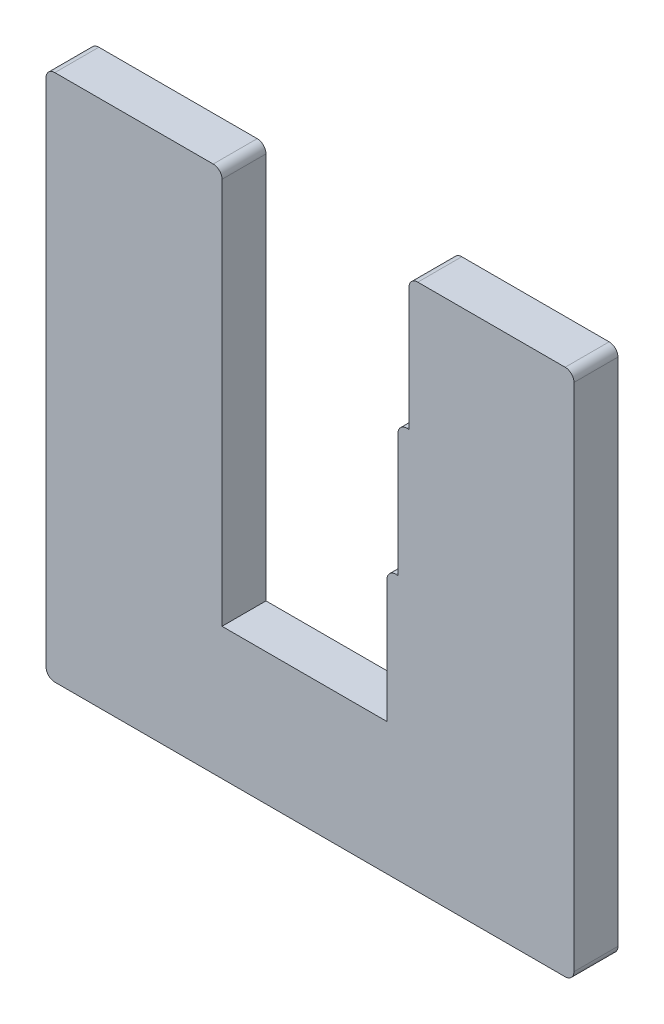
SolidWorks part; units mm, degrees
other "Objet de détail1"
other "Objet de détail2"
other "Objet de détail3"
ref_plane "Plan de face" through (0, 0, 0) normal (0, 0, 1) x (1, 0, 0)
ref_plane "Plan de dessus" through (0, 0, 0) normal (0, 1, 0) x (1, 0, 0)
ref_plane "Plan de droite" through (0, 0, 0) normal (1, 0, 0) x (0, 0, -1)
sketch "Esquisse1" plane through (0, 0, 0) normal (0, 0, 1) x (1, 0, 0)
  line L1 (0, 0) -> (120, 0)
  line L2 (0, 0) -> (0, 120)
  line L3 (0, 120) -> (120, 120)
  line L4 (120, 0) -> (120, 120)
  dimension "D1" = 120
  dimension "D2" = 120
extrude "Boss.-Extru.1" add sketch "Esquisse1" along normal blind 10
sketch "Esquisse2" plane through (0, 0, 10) normal (0, 0, 1) x (1, 0, 0)
  line L0 (120, 120) -> (0, 120) construction
  line L1 (40, 120) -> (82.5, 120)
  line L2 (40, 120) -> (40, 90)
  line L3 (40, 90) -> (82.5, 90)
  line L4 (82.5, 120) -> (82.5, 90)
  line L5 (0, 120) -> (0, 0) construction
  dimension "D1" = 40
  dimension "D2" = 42.5
  dimension "D3" = 30
extrude "Enlèv. mat.-Extru.1" cut sketch "Esquisse2" against normal blind 10
sketch "Esquisse3" plane through (0, 0, 10) normal (0, 0, 1) x (1, 0, 0)
  line L1 (40, 90) -> (80, 90)
  line L2 (40, 90) -> (40, 60)
  line L3 (40, 60) -> (80, 60)
  line L4 (80, 90) -> (80, 60)
  dimension "D1" = 30
  dimension "D2" = 40
extrude "Enlèv. mat.-Extru.2" cut sketch "Esquisse3" against normal blind 10
sketch "Esquisse4" plane through (0, 0, 10) normal (0, 0, 1) x (1, 0, 0)
  line L1 (40, 60) -> (77.5, 60)
  line L2 (40, 60) -> (40, 30)
  line L3 (40, 30) -> (77.5, 30)
  line L4 (77.5, 60) -> (77.5, 30)
  dimension "D1" = 37.5
  dimension "D2" = 30
extrude "Enlèv. mat.-Extru.3" cut sketch "Esquisse4" against normal blind 10
fillet "Congé1" radius 2 8 edges at (80, 90, 5) (77.5, 60, 5) (120, 0, 5) (0, 0, 5) (40, 120, 5) (82.5, 120, 5) (120, 120, 5) (0, 120, 5)
